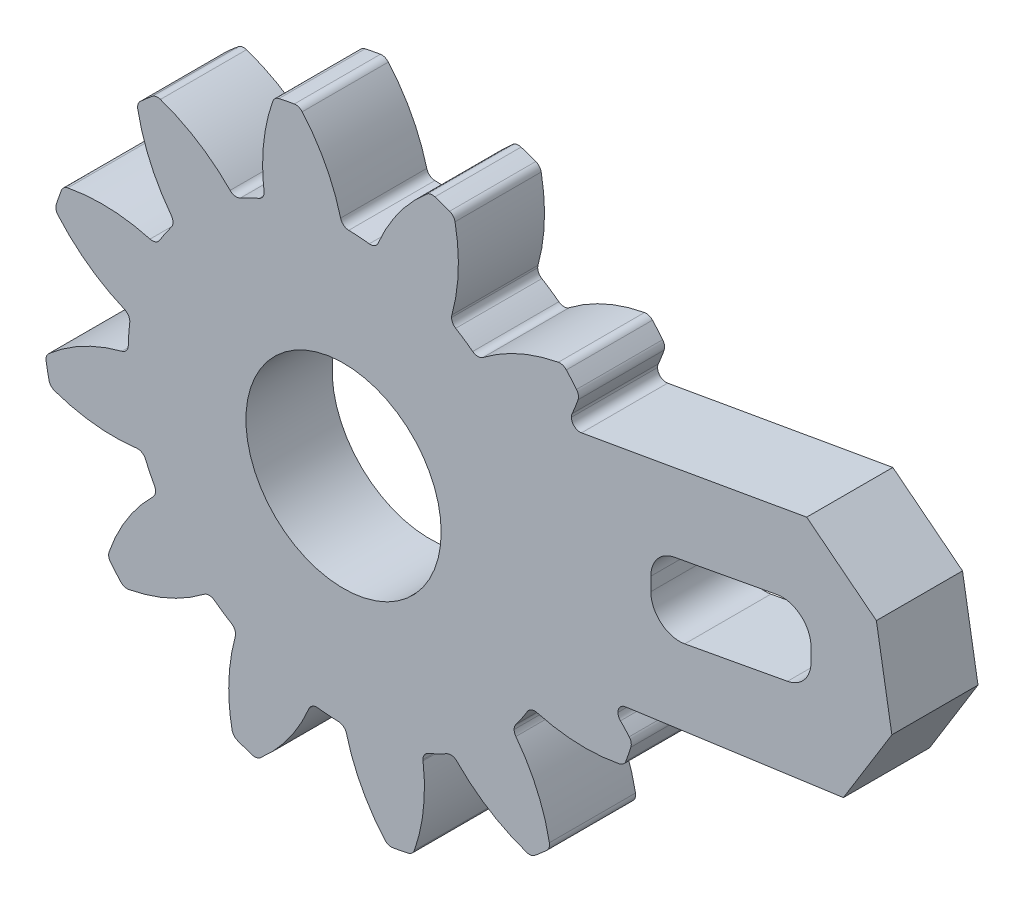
SolidWorks part; units mm, degrees
ref_plane "Front Plane" through (0, 0, 0) normal (0, 0, 1) x (1, 0, 0)
ref_plane "Top Plane" through (0, 0, 0) normal (0, 1, 0) x (1, 0, 0)
ref_plane "Right Plane" through (0, 0, 0) normal (1, 0, 0) x (0, 0, -1)
imported_body "Imported1"
sketch "Sketch3" plane through (0, 0, 3) normal (0, 0, 1) x (1, 0, 0)
  circle A0 centre (101.1588, 41.8935) radius 1.5
extrude "Extrude1" add sketch "Sketch3" against normal blind 3
sketch "Sketch2" plane through (0, 0, 3) normal (0, 0, 1) x (1, 0, 0)
  line L0 (112.6786, 45.201) -> (116.2573, 45.8613)
  line L1 (111.86, 44.2176) -> (111.86, 43.7514)
  line L2 (113.0414, 42.768) -> (116.6201, 43.4283)
  line L3 (117.4387, 44.8779) -> (117.4387, 44.4117)
  arc A0 (112.6786, 45.201) -> (111.86, 44.2176) centre (112.86, 44.2176) ccw
  circle A1 centre (101.1588, 41.8935) radius 3.4
  arc A2 (113.0414, 42.768) -> (111.86, 43.7514) centre (112.86, 43.7514) cw
  arc A3 (117.4387, 44.8779) -> (116.2573, 45.8613) centre (116.4387, 44.8779) ccw
  arc A4 (117.4387, 44.4117) -> (116.6201, 43.4283) centre (116.4387, 44.4117) cw
  dimension "D1" = 1
extrude "Cut-Extrude1" cut sketch "Sketch2" against normal blind 3
sketch "Sketch4" plane through (0, 0, 3) normal (0, 0, 1) x (1, 0, 0)
  line L2 (119.7154, 46.8065) -> (120.2546, 43.631)
  line L4 (137.8093, 52.6181) -> (137.8093, 34.9436)
  line L5 (112.5258, 56.4525) -> (137.8093, 52.6181)
  line L6 (112.5258, 56.4525) -> (113.0051, 52.0789)
  line L7 (113.0051, 52.0789) -> (119.7154, 46.8065)
  line L9 (120.2546, 43.631) -> (115.3417, 35.6625)
  line L11 (137.8093, 34.9436) -> (117.1391, 26.0764)
  line L12 (115.3417, 35.6625) -> (117.1391, 26.0764)
extrude "Cut-Extrude2" cut sketch "Sketch4" against normal blind 3
scale "Scale1" scale about centroid uniform scaling yes scale factor 1.1
